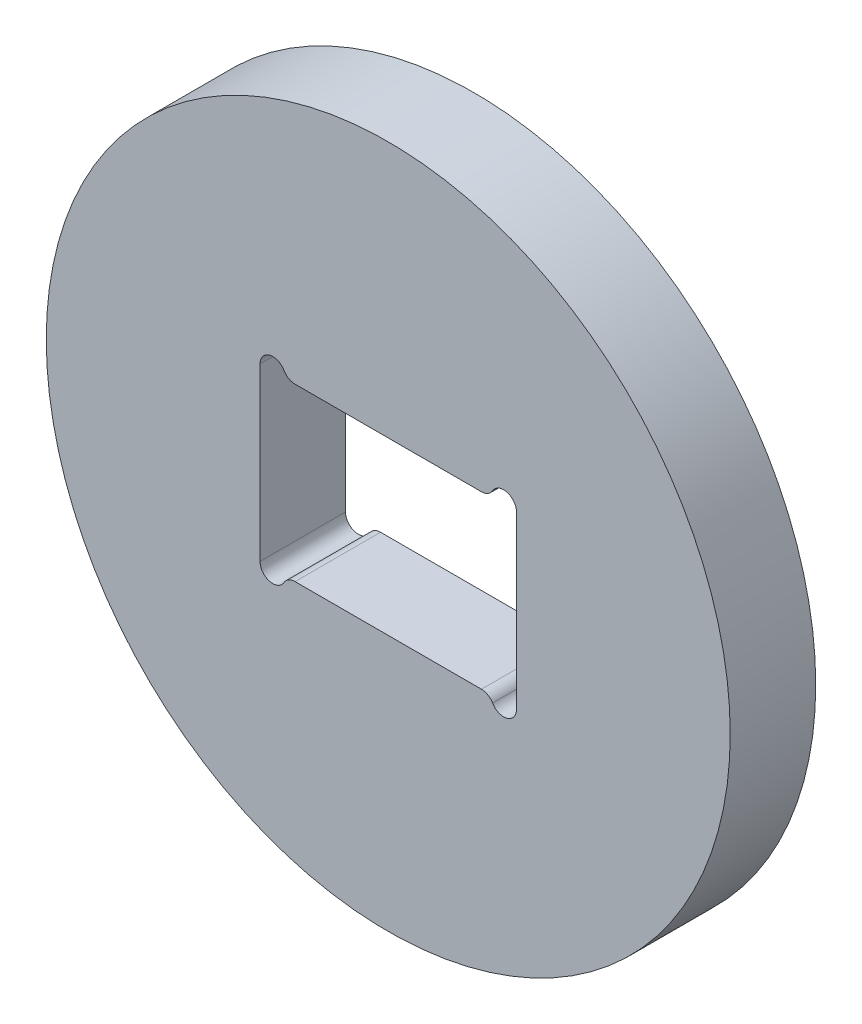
SolidWorks part; units mm, degrees
ref_plane "Plan de face" through (0, 0, 0) normal (0, 0, 1) x (1, 0, 0)
ref_plane "Plan de dessus" through (0, 0, 0) normal (0, 1, 0) x (1, 0, 0)
ref_plane "Plan de droite" through (0, 0, 0) normal (1, 0, 0) x (0, 0, -1)
sketch "Esquisse1" plane through (0, 0, 0) normal (0, 0, 1) x (1, 0, 0)
  line L4 (-10.9019, 10) -> (10.9019, 10)
  line L5 (15, 10) -> (15, -10)
  line L6 (10.9019, -10) -> (-10.9019, -10)
  line L7 (-15, -10) -> (-15, 10)
  arc A0 (-12.201, 10.75) -> (-10.9019, 10) centre (-10.9019, 11.5) ccw
  arc A1 (10.9019, 10) -> (12.201, 10.75) centre (10.9019, 11.5) ccw
  arc A2 (15, 10) -> (12.201, 10.75) centre (13.5, 10) ccw
  arc A3 (12.201, -10.75) -> (15, -10) centre (13.5, -10) ccw
  arc A4 (12.201, -10.75) -> (10.9019, -10) centre (10.9019, -11.5) ccw
  arc A18 (-10.9019, -10) -> (-12.201, -10.75) centre (-10.9019, -11.5) ccw
  arc A19 (-15, -10) -> (-12.201, -10.75) centre (-13.5, -10) ccw
  arc A20 (-12.201, 10.75) -> (-15, 10) centre (-13.5, 10) ccw
  circle A25 centre (0, 0) radius 40
  dimension "D5" = 1.5
  dimension "D6" = 1.5
  dimension "D7" = 1.5
  dimension "D8" = 1.5
  dimension "D9" = 1.5
  dimension "D10" = 1.5
  dimension "D11" = 1.5
  dimension "D12" = 1.5
  dimension "80" = 80
  dimension "D1" = 30
  dimension "D2" = 20
  dimension "D3" = 15
  dimension "D4" = 10
extrude "Boss.-Extru.1" add sketch "Esquisse1" along normal blind 10
